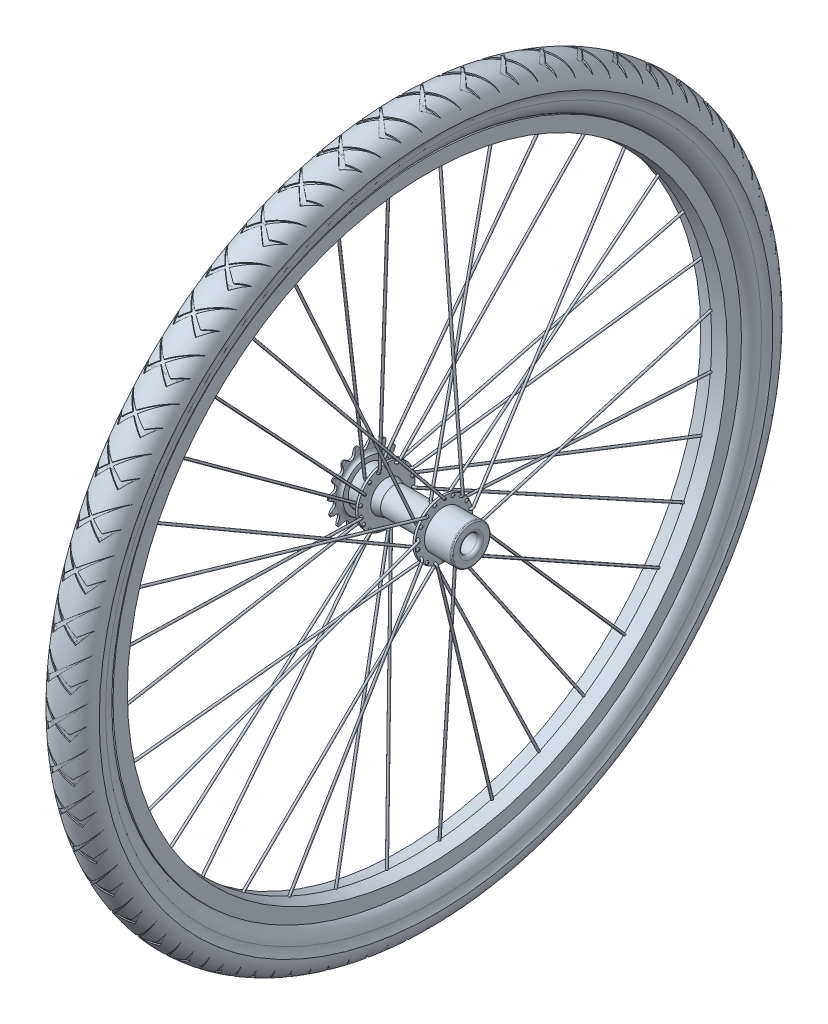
SolidWorks part; units mm, degrees
ref_plane "Front Plane" through (0, 0, 0) normal (0, 0, 1) x (1, 0, 0)
ref_plane "Top Plane" through (0, 0, 0) normal (0, 1, 0) x (1, 0, 0)
ref_plane "Right Plane" through (0, 0, 0) normal (1, 0, 0) x (0, 0, -1)
sketch "Sketch1" plane through (0, 0, 0) normal (0, 0, 1) x (1, 0, 0)
  line L0 (-39.2844, 0) -> (38.6872, 0) construction
  line L1 (0, 0) -> (0, 30.0284) construction
  line L2 (24, 10.5521) -> (-24, 10.5521)
  line L3 (-27, 13.5521) -> (-27, 15.5)
  line L4 (-27, 15.5) -> (-48, 15.5)
  line L5 (-48, 15.5) -> (-48, 17.5)
  line L6 (-48, 17.5) -> (-27, 17.5)
  line L7 (-27, 17.5) -> (-27, 26)
  line L8 (-27, 26) -> (-25, 26)
  line L9 (-25, 26) -> (-25, 14.2844)
  line L10 (-25, 14.2844) -> (-18, 12.2844)
  line L11 (-18, 12.2844) -> (18, 12.2844)
  line L12 (25, 26) -> (25, 14.2844)
  line L13 (27, 26) -> (25, 26)
  line L14 (27, 17.5) -> (27, 26)
  line L15 (27, 13.5521) -> (27, 15.5)
  line L16 (25, 14.2844) -> (18, 12.2844)
  line L17 (27, 17.5) -> (50, 17.5)
  line L18 (50, 17.5) -> (50, 15.5)
  line L19 (50, 15.5) -> (27, 15.5)
  arc A0 (-24, 10.5521) -> (-27, 13.5521) centre (-24, 13.5521) cw
  arc A1 (24, 10.5521) -> (27, 13.5521) centre (24, 13.5521) ccw
  point P5 (0, 12.2844)
  point P27 (0, 10.5521)
  dimension "D6" = 3
  dimension "D1" = 27
  dimension "D2" = 2
  dimension "D3" = 2
  dimension "D4" = 7
  dimension "D5" = 2
  dimension "D7" = 17.5
  dimension "D8" = 48
  dimension "D9" = 50
  dimension "D10" = 26
revolve "Revolve1" add sketch "Sketch1" angle 360 about L0
sketch "Sketch2" plane through (0, 0, 0) normal (1, 0, 0) x (0, 0, -1)
  line L0 (0, 0) -> (0, 41.4818) construction
  circle A0 centre (0, 24) radius 1
  dimension "D1" = 2
  dimension "D2" = 24
extrude "Cut-Extrude1" cut sketch "Sketch2" against normal through all and the other way through all
pattern_circular "CirPattern1" count 18 over 360 about axis through (0, 0, 0) along (1, 0, 0) of "Cut-Extrude1"
sketch "Sketch3" plane through (0, 0, 0) normal (0, 0, 1) x (1, 0, 0)
  line L0 (-48, 0) -> (50, 0) construction
  line L1 (-48, 17.5) -> (-48, -17.5) construction
  line L2 (50, -17.5) -> (50, 17.5) construction
  line L3 (0, 0) -> (0, 285) construction
  line L4 (12, 285) -> (12, 272)
  line L5 (12, 272) -> (0, 270)
  line L6 (0, 270) -> (-12, 272)
  line L7 (-12, 272) -> (-12, 285)
  line L8 (10, 284.5) -> (10, 275.3885)
  line L9 (8.3288, 273.4157) -> (0.4932, 272.1098)
  line L10 (-0.4932, 272.1098) -> (-8.3288, 273.4157)
  line L11 (-10, 275.3885) -> (-10, 284.5)
  line L12 (-12, 285) -> (-10.5, 285)
  line L13 (10.5, 285) -> (12, 285)
  line L14 (10, 285) -> (10, 273.6943) construction
  line L15 (10, 273.6943) -> (0, 272.0276) construction
  line L16 (0, 272.0276) -> (-10, 273.6943) construction
  line L17 (-10, 273.6943) -> (-10, 285) construction
  arc A0 (10, 275.3885) -> (8.3288, 273.4157) centre (8, 275.3885) cw
  arc A1 (-8.3288, 273.4157) -> (-10, 275.3885) centre (-8, 275.3885) cw
  arc A2 (10, 284.5) -> (10.5, 285) centre (10.5, 284.5) cw
  arc A3 (-10, 284.5) -> (-10.5, 285) centre (-10.5, 284.5) ccw
  arc A4 (0.4932, 272.1098) -> (-0.4932, 272.1098) centre (0, 275.069) cw
  dimension "D6" = 2
  dimension "D7" = 0.5
  dimension "D8" = 3
  dimension "D1" = 285
  dimension "D2" = 13
  dimension "D3" = 24
  dimension "D4" = 2
  dimension "D5" = 2
revolve "Revolve2" add sketch "Sketch3" angle 360 about L0
sketch "Sketch4" plane through (0, 0, 0) normal (1, 0, 0) x (0, 0, -1)
  line L0 (0, 273) -> (0, -273) construction
  line L1 (-273, 0) -> (273, 0) construction
  circle A0 centre (0, 0) radius 273
  dimension "D1" = 546
sketch3d "3DSketch1"
  line L0 (24, 4.1676, 23.6354) -> (26.7584, 4.1676, 23.6354)
  line L1 (25, 4.1676, 23.6354) -> (27, 4.1676, 23.6354) construction
  line L2 (28.7455, 3.112, 25.5964) -> (0, -116.1022, 247.0815)
  circle A0 centre (0, 0, 0) radius 273 construction
  circle A1 centre (25, 4.1676, 23.6354) radius 1 construction
  arc A2 (26.7584, 4.1676, 23.6354) -> (28.7455, 3.112, 25.5964) centre (26.7584, 3.2196, 25.3965) ccw
  point P7 (273, 0, 0)
  point P12 (26, 4.1676, 23.6354)
  point P16 (29, 4.1676, 23.6354)
  point P17 (26.7584, 1.4585, 24.4486)
  dimension "D4" = 2
  dimension "D1" = 1
  dimension "D2" = 5
  dimension "D3" = 118.96
ref_plane "Plane1" through (0, -116.1022, 247.0815) normal (-0.1135, -0.4709, 0.8749) x (0.9935, -0.0538, 0.1)
sketch "Sketch5" plane through (0, -116.1022, 247.0815) normal (-0.1135, -0.4709, 0.8749) x (0.9935, -0.0538, 0.1)
  circle A0 centre (0, 0) radius 1
  dimension "D1" = 2
sweep "Sweep1" add profiles "Sketch5" path "3DSketch1"
sketch "Sketch6" plane through (-30.7511, -127.5319, 236.9384) normal (-0.1135, -0.4709, 0.8749) x (0.9935, -0.0538, 0.1)
  circle A0 centre (30.9513, 14.8718) radius 1.5
  dimension "D1" = 3
extrude "Boss-Extrude1" add sketch "Sketch6" against normal blind 1
fillet "Fillet2" radius 1 1 edges at (0, -117.423, 246.3706)
sketch "Sketch7" plane through (24, 0, 0) normal (-1, 0, 0) x (0, 0, 1)
  circle A0 centre (23.6354, 4.1676) radius 1.5
  dimension "D1" = 3
extrude "Boss-Extrude2" add sketch "Sketch7" against normal blind 1
fillet "Fillet4" radius 1 1 edges at (24, 4.1676, 25.1354)
pattern_circular "CirPattern2" count 9 over 360 about axis through (12, 0, 0) along (-1, 0, 0) of "Sweep1", "Boss-Extrude1", "Fillet2", "Boss-Extrude2", "Fillet4"
sketch3d "3DSketch2"
  line L0 (28, -4.1676, 23.6354) -> (24.8269, -4.1676, 23.6354)
  line L1 (25, -4.1676, 23.6354) -> (27, -4.1676, 23.6354) construction
  line L2 (22.8351, -3.3052, 25.2375) -> (0, 116.1022, 247.0815)
  circle A0 centre (0, 0, 0) radius 273 construction
  circle A1 centre (27, -4.1676, 23.6354) radius 1 construction
  arc A2 (22.8351, -3.3052, 25.2375) -> (24.8269, -4.1676, 23.6354) centre (24.8269, -3.2196, 25.3965) ccw
  point P7 (273, 0, 0)
  point P12 (26, -4.1676, 23.6354)
  point P15 (23, -4.1676, 23.6354)
  point P16 (24.8269, -4.9807, 26.3444)
  dimension "D3" = 2
  dimension "D1" = 1
  dimension "D2" = 5
  dimension "D4" = 118.96
ref_plane "Plane2" through (0, 116.1022, 247.0815) normal (-0.0903, 0.472, 0.877) x (0.9959, 0.0428, 0.0795)
sketch "Sketch8" plane through (0, 116.1022, 247.0815) normal (-0.0903, 0.472, 0.877) x (0.9959, 0.0428, 0.0795)
  circle A0 centre (0, 0) radius 1
  dimension "D1" = 2
sweep "Sweep2" add profiles "Sketch8" path "3DSketch2"
sketch "Sketch9" plane through (-24.506, 128.1448, 238.0771) normal (-0.0903, 0.472, 0.877) x (0.9959, 0.0428, 0.0795)
  circle A0 centre (24.6065, -14.8718) radius 1.5
  dimension "D1" = 3
extrude "Boss-Extrude3" add sketch "Sketch9" against normal blind 1
fillet "Fillet5" radius 1 1 edges at (0, 114.7814, 247.7925)
sketch "Sketch10" plane through (28, 0, 0) normal (1, 0, 0) x (0, 0, -1)
  circle A0 centre (-23.6354, -4.1676) radius 1.5
  dimension "D1" = 3
extrude "Boss-Extrude4" add sketch "Sketch10" against normal blind 1
fillet "Fillet6" radius 1 1 edges at (28, -4.1676, 22.1354)
pattern_circular "CirPattern3" count 9 over 360 about axis through (12, 0, 0) along (-1, 0, 0) of "Sweep2", "Boss-Extrude3", "Fillet5", "Boss-Extrude4", "Fillet6"
sketch3d "3DSketch5"
  line L0 (-24, 24, 0) -> (-26.7561, 24, 0)
  line L1 (-27, 24, 0) -> (-25, 24, 0) construction
  line L2 (-28.743, 25.9773, -1.0291) -> (0, 247.0815, -116.1022)
  circle A3 centre (0, 0, 0) radius 273 construction
  arc A4 (-26.7561, 24, 0) -> (-28.743, 25.9773, -1.0291) centre (-26.7561, 25.7741, -0.9233) ccw
  circle A5 centre (-25, 24, 0) radius 1 construction
  point P10 (273, 0, 0)
  point P11 (-29, 24, 0)
  point P12 (-26.7561, 24.8508, -2.6974)
  point P15 (-26, 24, 0)
  dimension "D1" = 2
  dimension "D2" = 1
  dimension "D3" = 5
  dimension "D4" = 118.96
ref_plane "Plane3" through (0, 247.0815, -116.1022) normal (0.1146, 0.8812, -0.4586) x (0.9934, -0.1016, 0.0529)
sketch "Sketch11" plane through (0, 247.0815, -116.1022) normal (0.1146, 0.8812, -0.4586) x (0.9934, -0.1016, 0.0529)
  circle A0 centre (0, 0) radius 1
  dimension "D1" = 2
sweep "Sweep3" add profiles "Sketch11" path "3DSketch5"
sketch "Sketch12" plane through (31.0422, 238.791, -124.2781) normal (0.1146, 0.8812, -0.4586) x (0.9934, -0.1016, 0.0529)
  circle A0 centre (-31.2479, -11.08) radius 1.5
  dimension "D1" = 3
extrude "Boss-Extrude5" add sketch "Sketch12" against normal blind 1
fillet "Fillet7" radius 1 1 edges at (0, 247.774, -114.7716)
sketch "Sketch13" plane through (-24, 0, 0) normal (1, 0, 0) x (0, 0, -1)
  circle A0 centre (0, 24) radius 1.5
  dimension "D1" = 3
extrude "Boss-Extrude6" add sketch "Sketch13" against normal blind 1
fillet "Fillet8" radius 1 1 edges at (-24, 24, -1.5)
pattern_circular "CirPattern4" count 9 over 360 about axis through (-12, 0, 0) along (-1, 0, 0) of "Sweep3", "Boss-Extrude5", "Fillet7", "Boss-Extrude6", "Fillet8"
sketch3d "3DSketch7"
  line L0 (-28, -4.1676, -23.6354) -> (-24.8244, -4.1676, -23.6354)
  line L1 (-22.8328, -4.9812, -25.2597) -> (0, -116.1022, -247.0815)
  circle A1 centre (-27, -4.1676, -23.6354) radius 1 construction
  arc A2 (-24.8244, -4.1676, -23.6354) -> (-22.8328, -4.9812, -25.2597) centre (-24.8244, -5.0633, -25.4236) ccw
  circle A3 centre (0, 0, 0) radius 273 construction
  point P12 (-26, -4.1676, -23.6354)
  point P15 (-23, -4.1676, -23.6354)
  point P16 (-24.8244, -3.2752, -26.3193)
  point P20 (273, 0, 0)
  dimension "D3" = 2
  dimension "D1" = 1
  dimension "D2" = 5
  dimension "D4" = 118.96
ref_plane "Plane4" through (0, -116.1022, -247.0815) normal (0.0916, -0.446, -0.8903) x (-0.9958, -0.041, -0.0819)
sketch "Sketch14" plane through (0, -116.1022, -247.0815) normal (0.0916, -0.446, -0.8903) x (-0.9958, -0.041, -0.0819)
  circle A0 centre (0, 0) radius 1
  dimension "D1" = 2
sweep "Sweep4" add profiles "Sketch14" path "3DSketch7"
sketch "Sketch15" plane through (24.9057, -121.2089, -241.9597) normal (0.0916, -0.446, -0.8903) x (-0.9958, -0.041, -0.0819)
  circle A0 centre (25.0109, 6.8599) radius 1.5
  dimension "D1" = 3
extrude "Boss-Extrude7" add sketch "Sketch15" against normal blind 1
fillet "Fillet9" radius 1 1 edges at (0, -114.761, -247.7534)
sketch "Sketch16" plane through (-28, 0, 0) normal (-1, 0, 0) x (0, 0, 1)
  circle A0 centre (-23.6354, -4.1676) radius 1.5
  dimension "D1" = 3
extrude "Boss-Extrude8" add sketch "Sketch16" against normal blind 1
fillet "Fillet10" radius 1 1 edges at (-28, -5.6676, -23.6354)
pattern_circular "CirPattern5" count 9 over 360 about axis through (-12, 0, 0) along (-1, 0, 0) of "Sweep4", "Boss-Extrude7", "Fillet9", "Boss-Extrude8", "Fillet10"
sketch "Sketch17" plane through (0, 0, 0) normal (0, 0, 1) x (1, 0, 0)
  line L0 (-48, 0) -> (50, 0) construction
  line L1 (50, 17.5) -> (49.9985, 10.9853)
  line L2 (49.0131, 9.9856) -> (37.9416, 9.8239)
  line L3 (34, 5.8244) -> (34, 5.5)
  line L4 (52, 17.4995) -> (51.9985, 10.9848)
  line L5 (49.0423, 7.9858) -> (37.9708, 7.8241)
  line L6 (36, 5.8244) -> (36, 5.5)
  line L7 (1, 0) -> (1, 14.5273) construction
  line L8 (34, 5.5) -> (36, 5.5)
  line L9 (52, 17.4995) -> (50, 17.5)
  line L10 (-50, 17.4995) -> (-48, 17.5)
  line L11 (-32, 5.5) -> (-34, 5.5)
  line L12 (-34, 5.8244) -> (-34, 5.5)
  line L13 (-47.0423, 7.9858) -> (-35.9708, 7.8241)
  line L14 (-50, 17.4995) -> (-49.9985, 10.9848)
  line L15 (-32, 5.8244) -> (-32, 5.5)
  line L16 (-47.0131, 9.9856) -> (-35.9416, 9.8239)
  line L17 (-48, 17.5) -> (-47.9985, 10.9853)
  arc A0 (49.9985, 10.9853) -> (49.0131, 9.9856) centre (48.9985, 10.9855) cw
  arc A1 (37.9416, 9.8239) -> (34, 5.8244) centre (38, 5.8244) ccw
  arc A2 (51.9985, 10.9848) -> (49.0423, 7.9858) centre (48.9985, 10.9855) cw
  arc A3 (37.9708, 7.8241) -> (36, 5.8244) centre (38, 5.8244) ccw
  arc A4 (-35.9708, 7.8241) -> (-34, 5.8244) centre (-36, 5.8244) cw
  arc A5 (-49.9985, 10.9848) -> (-47.0423, 7.9858) centre (-46.9985, 10.9855) ccw
  arc A6 (-35.9416, 9.8239) -> (-32, 5.8244) centre (-36, 5.8244) cw
  arc A7 (-47.9985, 10.9853) -> (-47.0131, 9.9856) centre (-46.9985, 10.9855) ccw
  point P11 (49.9983, 10)
  point P14 (34, 9.7664)
  point P35 (-32, 9.7664)
  point P38 (-47.9983, 10)
  dimension "D5" = 1
  dimension "D6" = 4
  dimension "D1" = 7.5
  dimension "D2" = 16
  dimension "D3" = 17.5
  dimension "D4" = 5.5
  dimension "D8" = 49
  dimension "D7" = 2
revolve "Revolve3" add sketch "Sketch17" angle 360 about L0
fillet "Fillet11" radius 1 2 edges at (-50, 0, 17.4995) (52, 0, 17.4995)
sketch "Sketch18" plane through (0, 0, 0) normal (0, 0, 1) x (1, 0, 0)
  line L0 (-49.9998, -0.1699) -> (51.9998, -0.1699) construction
  line L1 (-45.9998, -0.1699) -> (-45.9998, 94.4226) construction
  line L2 (-49.9998, -16.4995) -> (-49.9998, 16.4995) construction
  line L3 (-41.9998, 17.5) -> (-49.9998, 17.5)
  line L4 (-41.9998, 17.5) -> (-41.9998, 22.3301)
  line L5 (-41.9998, 22.3301) -> (-44.9998, 22.3301)
  line L6 (-49.9998, 17.5) -> (-49.9998, 22.3301)
  line L7 (-46.9998, 22.3301) -> (-49.9998, 22.3301)
  line L9 (-44.9998, 22.3301) -> (-44.9998, 32.8301)
  line L10 (-44.9998, 32.8301) -> (-46.9998, 32.8301)
  line L11 (-46.9998, 22.3301) -> (-46.9998, 32.8301)
  point P8 (0, 0)
  dimension "D1" = 4
  dimension "D2" = 8
  dimension "D3" = 22.5
  dimension "D4" = 2
  dimension "D5" = 33
revolve "Revolve4" add sketch "Sketch18" angle 360 about L0
fillet "Fillet12" radius 3 2 edges at (-44.9998, -0.1699, 22.5) (-46.9998, -0.1699, 22.5)
sketch "Sketch22" plane through (-46.9998, 0, 0) normal (-1, 0, 0) x (0, 0, 1)
  line L0 (0, 0) -> (0, 32.8301) construction
  line L1 (0, 29.7) -> (-10.0074, 29.7) construction
  line L2 (0, 29.7) -> (-8.0676, 25.3233) construction
  arc A0 (-3.0764, 28.031) -> (3.0764, 28.031) centre (0, 29.7) ccw
  arc A1 (-6.0702, 32.267) -> (-3.0764, 28.031) centre (-22.4141, 17.5403) cw
  circle A2 centre (0, -0.1699) radius 33 construction
  arc A3 (6.0702, 32.267) -> (3.0764, 28.031) centre (22.4141, 17.5403) ccw
  arc A4 (-6.0702, 32.267) -> (6.0702, 32.267) centre (0, 0) cw
  dimension "D1" = 7
  dimension "D4" = 22
  dimension "D2" = 29.7
  dimension "D3" = 28.48
extrude "Cut-Extrude3" cut sketch "Sketch22" against normal up to next
pattern_circular "CirPattern7" count 15 over 360 about axis through (0, -0.1699, 0) along (1, 0, 0) of "Cut-Extrude3"
sketch "Sketch23" plane through (0, 0, 0) normal (0, 0, 1) x (1, 0, 0)
  line L0 (-49.9998, -0.1699) -> (0, 0) construction
  line L1 (-45.9998, -0.1563) -> (-45.9998, 41.1198) construction
  line L2 (-46.9998, 31.9316) -> (-46.9998, 26.8442) construction
  line L3 (-44.9998, 26.8442) -> (-44.9998, 31.9316) construction
  line L4 (-46.9998, 29.267) -> (-46.4998, 32.267)
  line L5 (-46.4998, 32.267) -> (-45.4998, 32.267)
  line L6 (-45.4998, 32.267) -> (-44.9998, 29.267)
  line L7 (-46.9998, 32.267) -> (-44.9998, 32.267) construction
  line L8 (-46.9998, 29.267) -> (-47.2498, 29.267)
  line L9 (-47.2498, 29.267) -> (-47.2498, 33.267)
  line L10 (-47.2498, 33.267) -> (-44.7498, 33.267)
  line L11 (-44.7498, 33.267) -> (-44.7498, 29.267)
  line L12 (-44.7498, 29.267) -> (-44.9998, 29.267)
  dimension "D1" = 1
  dimension "D2" = 3
  dimension "D3" = 3
  dimension "D4" = 2.5
  dimension "D5" = 4
revolve "Cut-Revolve1" cut sketch "Sketch23" angle 360 about L0
sketch "Sketch25" plane through (0, 0, 0) normal (0, 0, 1) x (1, 0, 0)
  line L0 (-27, 0) -> (27, 0) construction
  line L1 (0, 0) -> (0, 325.5898) construction
  line L2 (-10, 280.9957) -> (-10, 284.4155)
  line L3 (-0.4932, 263.4019) -> (-0.4932, 271.0154) construction
  line L4 (0.4932, 263.3852) -> (0.4932, 271.0207) construction
  line L5 (-8, 280.9957) -> (-8, 284.4155)
  line L6 (-10, 280.9957) -> (-8, 280.9957)
  line L7 (8, 280.9957) -> (8, 284.4155)
  line L8 (10, 280.9957) -> (10, 284.4155)
  line L9 (10, 280.9957) -> (8, 280.9957)
  arc A0 (-10.4878, 285.2744) -> (-17.79, 297.4957) centre (-2.8046, 298.1573) cw
  arc A1 (-17.79, 297.4957) -> (-20, 305.4957) centre (-30.7701, 298.2152) ccw
  arc A2 (-20, 305.4957) -> (0, 325.4957) centre (0, 305.4957) cw
  arc A3 (-10, 284.4155) -> (-10.4878, 285.2744) centre (-11, 284.4155) ccw
  arc A4 (-8, 284.4155) -> (-9.4634, 286.9921) centre (-11, 284.4155) ccw
  arc A5 (-9.4634, 286.9921) -> (-15.7875, 297.4916) centre (-2.8046, 298.1573) cw
  arc A6 (-15.7875, 297.4916) -> (-17.9908, 306.0696) centre (-30.7701, 298.2152) ccw
  arc A7 (-17.9908, 306.0696) -> (0, 323.4957) centre (0, 305.4957) cw
  arc A8 (17.9908, 306.0696) -> (0, 323.4957) centre (0, 305.4957) ccw
  arc A9 (15.7875, 297.4916) -> (17.9908, 306.0696) centre (30.7701, 298.2152) cw
  arc A10 (9.4634, 286.9921) -> (15.7875, 297.4916) centre (2.8046, 298.1573) ccw
  arc A11 (8, 284.4155) -> (9.4634, 286.9921) centre (11, 284.4155) cw
  arc A12 (10, 284.4155) -> (10.4878, 285.2744) centre (11, 284.4155) cw
  arc A13 (20, 305.4957) -> (0, 325.4957) centre (0, 305.4957) ccw
  arc A14 (17.79, 297.4957) -> (20, 305.4957) centre (30.7701, 298.2152) cw
  arc A15 (10.4878, 285.2744) -> (17.79, 297.4957) centre (2.8046, 298.1573) ccw
  point P19 (-10, 284.9957)
  point P38 (10, 284.9957)
  dimension "D8" = 20
  dimension "D9" = 15
  dimension "D10" = 13
  dimension "D11" = 1
  dimension "D1" = 7.58
  dimension "D2" = 4
  dimension "D3" = 12.5
  dimension "D4" = 17.79
  dimension "D5" = 20
  dimension "D6" = 8
  dimension "D7" = 20
  dimension "D12" = 2
revolve "Revolve5" add sketch "Sketch25" angle 360 about L0
sketch "Sketch26" plane through (0, 0, 0) normal (0, 0, 1) x (1, 0, 0)
  line L0 (-25, 0) -> (25, 0) construction
  arc A2 (19, 305.4957) -> (-19, 305.4957) centre (0, 305.4957) ccw
  arc A3 (19, 305.4957) -> (-19, 305.4957) centre (0, 305.4957) ccw
  dimension "D1" = 1
surface "Surface-Revolve1" sketch "Sketch26" parameters "D1"=360
ref_plane "Plane5" through (0, 0, 340) normal (0, 0, 1) x (1, 0, 0)
sketch "Sketch27" plane through (0, 0, 340) normal (0, 0, 1) x (1, 0, 0)
  line L0 (-18.7884, 15.8806) -> (0, 0)
  line L1 (10.2334, -8.6497) -> (17.8707, -2.1943)
  line L2 (0, 0) -> (0, 26.8253) construction
  line L3 (-10.2334, -8.6497) -> (-17.8707, -2.1943)
  line L4 (18.7884, 15.8806) -> (0, 0)
  line L5 (-17.8707, -2.1943) -> (-10.2334, -14.6497)
  line L6 (-10.2334, -14.6497) -> (0, -3.8843)
  line L7 (17.8707, -2.1943) -> (10.2334, -14.6497)
  line L8 (10.2334, -14.6497) -> (0, -3.8843)
  line L9 (-2.0474, -1.7305) -> (-10.2334, -8.6497)
  line L10 (2.0474, -1.7305) -> (18.7884, 15.8806)
  line L11 (2.0474, -1.7305) -> (10.2334, -8.6497)
  line L12 (-2.0474, -1.7305) -> (-18.7884, 15.8806)
  dimension "D1" = 10
  dimension "D2" = 38
  dimension "D3" = 6
extrude "Cut-Extrude4" cut sketch "Sketch27" against normal up to surface (15.6195 mm away)
pattern_circular "CirPattern8" count 55 over 360 about axis through (0, 0, 0) along (1, 0, 0) of "Cut-Extrude4"
